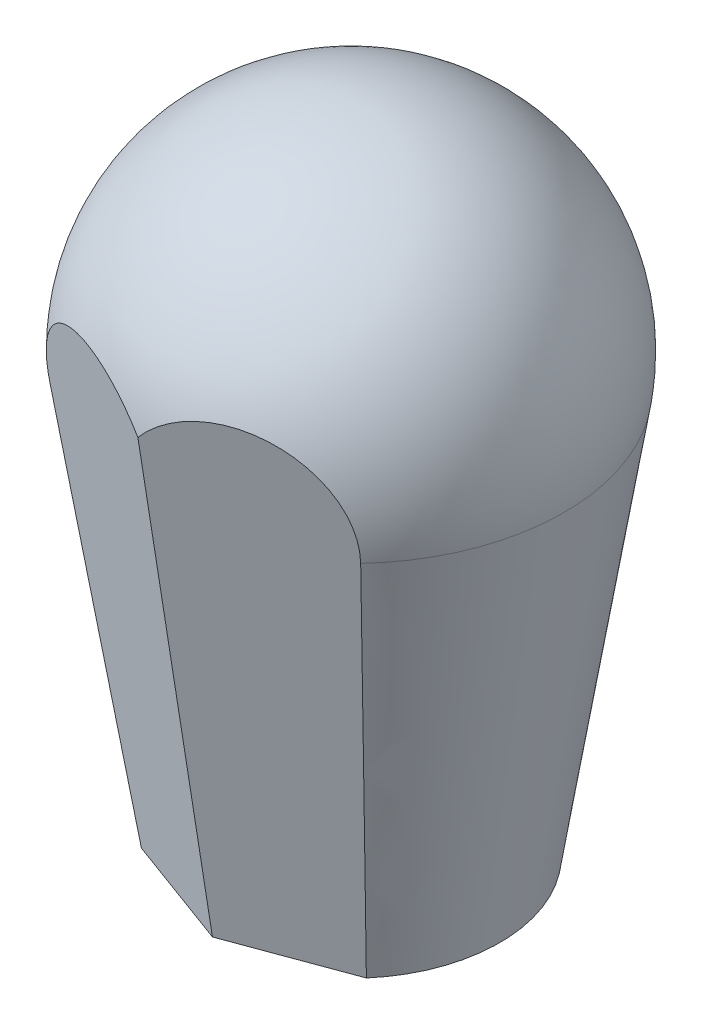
SolidWorks part; units mm, degrees
ref_plane "Plan de face" through (0, 0, 0) normal (0, 0, 1) x (1, 0, 0)
ref_plane "Plan de dessus" through (0, 0, 0) normal (0, 1, 0) x (1, 0, 0)
ref_plane "Plan de droite" through (0, 0, 0) normal (1, 0, 0) x (0, 0, -1)
sketch "Esquisse1" plane through (0, 0, 0) normal (0, 0, 1) x (1, 0, 0)
  line L0 (0, 160.044) -> (0, -211.1445) construction
  line L1 (0, 24) -> (-60, 24)
  line L2 (-60, 24) -> (-85.9248, 187.3643)
  line L3 (0, 288) -> (0, 24)
  arc A0 (0, 288) -> (-85.9248, 187.3643) centre (0, 201) ccw
  dimension "D1" = 174
  dimension "D2" = 264
  dimension "D3" = 120
  dimension "D4" = 24
revolve "Révolution1" add sketch "Esquisse1" angle 360 about L0
sketch "Esquisse2" plane through (0, 0, 0) normal (0, 0, 1) x (1, 0, 0)
  line L0 (0, -63.114) -> (0, 65.0036) construction
  line L1 (0, 48) -> (0, -48)
  arc A0 (0, 48) -> (0, -48) centre (0, 0) ccw
  dimension "D1" = 96
revolve "Enlèvement de matière-Révolution2" cut sketch "Esquisse2" angle 360 about L0
sketch "Esquisse4" plane through (0, 24, 0) normal (0, -1, 0) x (1, 0, 0)
  circle A0 centre (0, 0) radius 60 construction
  point P0 (0, 60)
ref_plane "Plan1" through (0, 24, 60) normal (0, -0.1567, 0.9876) x (1, 0, 0)
ref_plane "Plan2" through (0, -8.0712, 50.8605) normal (0, -0.1567, 0.9876) x (1, 0, 0)
sketch "Esquisse11" plane through (0, -8.0712, 50.8605) normal (0, -0.1567, 0.9876) x (1, 0, 0)
  line L0 (0, -15.1074) -> (0, 244.1604) construction
ref_plane "Plan3" through (16.5508, -7.1271, 44.9109) normal (0.342, -0.1473, 0.9281) x (0.9397, 0.0536, -0.3378)
sketch "Esquisse12" plane through (16.5508, -7.1271, 44.9109) normal (0.342, -0.1473, 0.9281) x (0.9397, 0.0536, -0.3378)
  line L1 (-58.6236, 26.9811) -> (243.1592, 26.9811)
  line L2 (-58.6236, 26.9811) -> (-58.6236, 317.01)
  line L3 (-58.6236, 317.01) -> (243.1592, 317.01)
  line L4 (243.1592, 26.9811) -> (243.1592, 317.01)
  ellipse E0 centre (1.2865, 23.7034) end of major axis (61.1983, 20.4516) minor radius 8.8368 construction
extrude "Enlèv. mat.-Extru.1" cut sketch "Esquisse12" along normal blind 10
mirror "Symétrie1" about plane through (0, 0, 0) normal (1, 0, 0) of "Enlèv. mat.-Extru.1"
